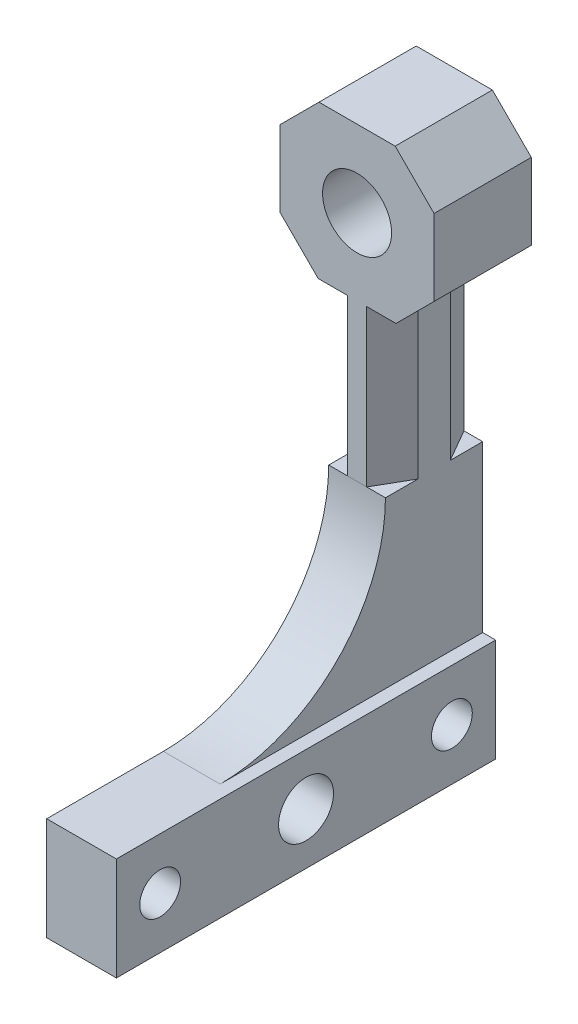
SolidWorks part; units mm, degrees
ref_plane "Front" through (0, 0, 0) normal (0, 0, 1) x (1, 0, 0)
ref_plane "Top" through (0, 0, 0) normal (0, 1, 0) x (1, 0, 0)
ref_plane "center" through (0, 0, 0) normal (1, 0, 0) x (0, 0, -1)
sketch "Sketch1" plane through (0, 0, 0) normal (0, 0, 1) x (1, 0, 0)
  line L0 (-2.2225, -6.0325) -> (-2.2225, -31.1658)
  line L1 (-6.0325, 6.0325) -> (6.0325, 6.0325)
  line L2 (-6.0325, 6.0325) -> (-6.0325, -6.0325)
  line L3 (-6.0325, -6.0325) -> (-2.2225, -6.0325)
  line L4 (6.0325, 6.0325) -> (6.0325, -6.0325)
  line L5 (-2.2225, -31.1658) -> (2.2225, -31.1658)
  line L6 (2.2225, -31.1658) -> (2.2225, -6.0325)
  line L7 (2.2225, -6.0325) -> (6.0325, -6.0325)
  point P4 (0, 6.0325)
  point P5 (-6.0325, 0)
  point P11 (0, -31.1658)
  dimension "D1" = 12.065
  dimension "D2" = 31.1658
  dimension "D3" = 4.445
extrude "Extrude1" add sketch "Sketch1" along normal blind 7.62
sketch "Sketch2" plane through (0, 0, 0) normal (0, 0, -1) x (-1, 0, 0)
  circle A0 centre (0, 0) radius 4.064
  dimension "D1" = 8.128
extrude "Cut-Extrude1" [suppressed] cut sketch "Sketch2" against normal through all
sketch "Sketch3" plane through (0, 0, 0) normal (1, 0, 0) x (0, 0, -1)
  line L0 (-7.62, -31.1658) -> (0, -31.1658) construction
  line L1 (-29.718, -31.1658) -> (0, -31.1658)
  line L2 (-29.718, -31.1658) -> (-29.718, -39.243)
  line L3 (-29.718, -39.243) -> (0, -39.243)
  line L4 (0, -31.1658) -> (0, -39.243)
  line L5 (0, -31.1658) -> (0, -6.0325) construction
  dimension "D1" = 29.718
  dimension "D2" = 8.0772
extrude "Extrude2" add sketch "Sketch3" along normal up to surface (2.2225 mm away) and the other way blind 2.2225
sketch "Sketch10" plane through (2.2225, 0, 0) normal (1, 0, 0) x (0, 0, -1)
  line L0 (0, -39.243) -> (0, -6.0325) construction
  line L1 (-29.718, -39.243) -> (0, -39.243)
  line L2 (-29.718, -39.243) -> (-29.718, -31.1658)
  line L3 (-29.718, -31.1658) -> (0, -31.1658)
  line L4 (0, -39.243) -> (0, -31.1658)
  line L5 (-29.718, -31.1658) -> (-7.62, -31.1658) construction
extrude "Extrude3" add sketch "Sketch10" along normal blind 1.016
fillet "Fillet3" radius 12.954 1 edges
hole_wizard "#18 (0.169500) Diameter Hole1" positions "Sketch5" profile "Sketch4" hole size "#18" standard "Ansi Inch"
sketch "Sketch5" plane through (3.2385, 1.2084, -11.7861) normal (1, 0, 0) x (0, 0, -1)
  line L0 (-11.7861, -40.4514) -> (-41.5041, -32.3742) construction
  point P0 (-26.6451, -36.4128)
sketch "Sketch4" plane through (3.2385, -35.2044, 14.859) normal (0, 1, 0) x (0, 0, -1)
  line L0 (0, 0) -> (0, 9.271)
  line L1 (0, 9.271) -> (2.1526, 9.271)
  line L2 (2.1526, 9.271) -> (2.1526, 0)
  line L5 (2.1526, 0) -> (0, 0)
  line L11 (0, -6.35) -> (0, 107.95) construction
  dimension "Thru Hole Dia." = 4.3053
  dimension "Thru Hole Depth" = 9.271
hole_wizard "1/4-28 Tapped Hole1" positions "Sketch7" profile "Sketch6" tap size "1/4-28" standard "Ansi Inch"
sketch "Sketch7" plane through (0, 0, 0) normal (0, 0, -1) x (-1, 0, 0)
  point P0 (0, 0)
sketch "Sketch6" plane through (0, 0, 0) normal (1, 0, 0) x (0, 1, 0)
  line L0 (0, 0) -> (0, 29.718)
  line L1 (0, 29.718) -> (2.7051, 29.718)
  line L2 (2.7051, 29.718) -> (2.7051, 0)
  line L5 (2.7051, 0) -> (0, 0)
  line L11 (0, -6.35) -> (0, 107.95) construction
  dimension "Thru Tap Drill Dia." = 5.4102
  dimension "Thru Tap Drill Depth" = 29.718
chamfer "Chamfer1" distance 3.048 angle 45 4 edges at (6.0325, -6.0325, 3.81) (6.0325, 6.0325, 3.81) (-6.0325, 6.0325, 3.81) (-6.0325, -6.0325, 3.81)
hole_wizard "1/8 LC2 Hole" positions "Sketch9" profile "Sketch8" hole size "1/8" standard "Ansi Inch"
sketch "Sketch9" plane through (3.2385, 0.5076, -7.3458) normal (1, 0, 0) x (0, 0, -1)
  circle A0 centre (-10.7748, -35.712) radius 1.5837 construction
  circle A1 centre (-33.6348, -35.712) radius 1.5837 construction
  point P0 (-33.6348, -35.712)
  point P1 (-10.7748, -35.712)
sketch "Sketch8" plane through (3.2385, -35.2044, 26.289) normal (0, 1, 0) x (0, 0, -1)
  line L0 (0, 0) -> (0, 9.271)
  line L1 (0, 9.271) -> (1.6002, 9.271)
  line L2 (1.6002, 9.271) -> (1.6002, 0)
  line L5 (1.6002, 0) -> (0, 0)
  line L11 (0, -6.35) -> (0, 107.95) construction
  dimension "Thru Hole Dia." = 3.2004
  dimension "Thru Hole Depth" = 9.271
chamfer "Chamfer2" [suppressed] distance 17.78 angle 45
fillet "Fillet4" [suppressed] radius 6.604
sketch "Sketch11" [suppressed] plane through (2.2225, 0, 0) normal (1, 0, 0) x (0, 0, -1)
  line L0 (-7.62, -13.3858) -> (-25.4, -31.1658) construction
  line L1 (0, -31.1658) -> (0, -6.0325) construction
  circle A0 centre (-8.636, -26.6149) radius 3.9688
  dimension "D1" = 7.9375
  dimension "D2" = 8.636
  dimension "D3" = 8.636
extrude "Cut-Extrude2" [suppressed] cut sketch "Sketch11" against normal through all
sketch "Sketch12" plane through (3.2385, 0, 0) normal (1, 0, 0) x (0, 0, -1)
  line L1 (-29.718, -31.1658) -> (0, -31.1658)
  line L2 (-29.718, -31.1658) -> (-29.718, -39.243)
  line L3 (-29.718, -39.243) -> (0, -39.243)
  line L4 (0, -31.1658) -> (0, -39.243)
extrude "Cut-Extrude3" [suppressed] cut sketch "Sketch12" against normal up to surface (1.016 mm away)
ref_plane "Knife Edge Plane" through (0, -5.969, 0) normal (0, 1, 0) x (-1, 0, 0)
sketch "Sketch14" plane through (0, -5.969, 0) normal (0, 1, 0) x (-1, 0, 0)
  line L0 (0.756, 7.62) -> (2.2225, 5.08)
  line L1 (2.2225, 1.8288) -> (2.2225, 5.0292) construction
  line L2 (2.2225, 29.718) -> (2.2225, 0) construction
  line L3 (2.2225, 5.08) -> (2.2225, 2.54)
  line L4 (2.2225, 2.54) -> (0.756, 0)
  line L5 (-3.2385, 0) -> (2.2225, 0) construction
  line L6 (0.756, 0) -> (-0.756, 0)
  line L7 (-0.756, 0) -> (-2.2225, 2.54)
  line L8 (-2.2225, 0) -> (-2.2225, 20.574) construction
  line L9 (-2.2225, 2.54) -> (-2.2225, 5.08)
  line L10 (-2.2225, 5.08) -> (-0.756, 7.62)
  line L11 (2.2225, 7.62) -> (-2.2225, 7.62) construction
  line L12 (-0.756, 7.62) -> (0.756, 7.62)
  line L13 (-2.2225, 5.08) -> (-2.2225, 7.4514) construction
  line L14 (2.2225, 5.08) -> (2.2225, 7.4514) construction
  line L15 (2.2225, 2.54) -> (2.2225, 0.3033) construction
  line L16 (-2.2225, 2.54) -> (-2.2225, 0.3033) construction
  dimension "D1" = 2.54
  dimension "D2" = 2.54
  dimension "D3" = 2.54
  dimension "D4" = 2.54
  dimension "D5" = 30
  dimension "D6" = 30
  dimension "D7" = 30
extrude "Cut-Extrude5" cut sketch "Sketch14" against normal up to vertex (12.2428 mm away) flip side to cut
